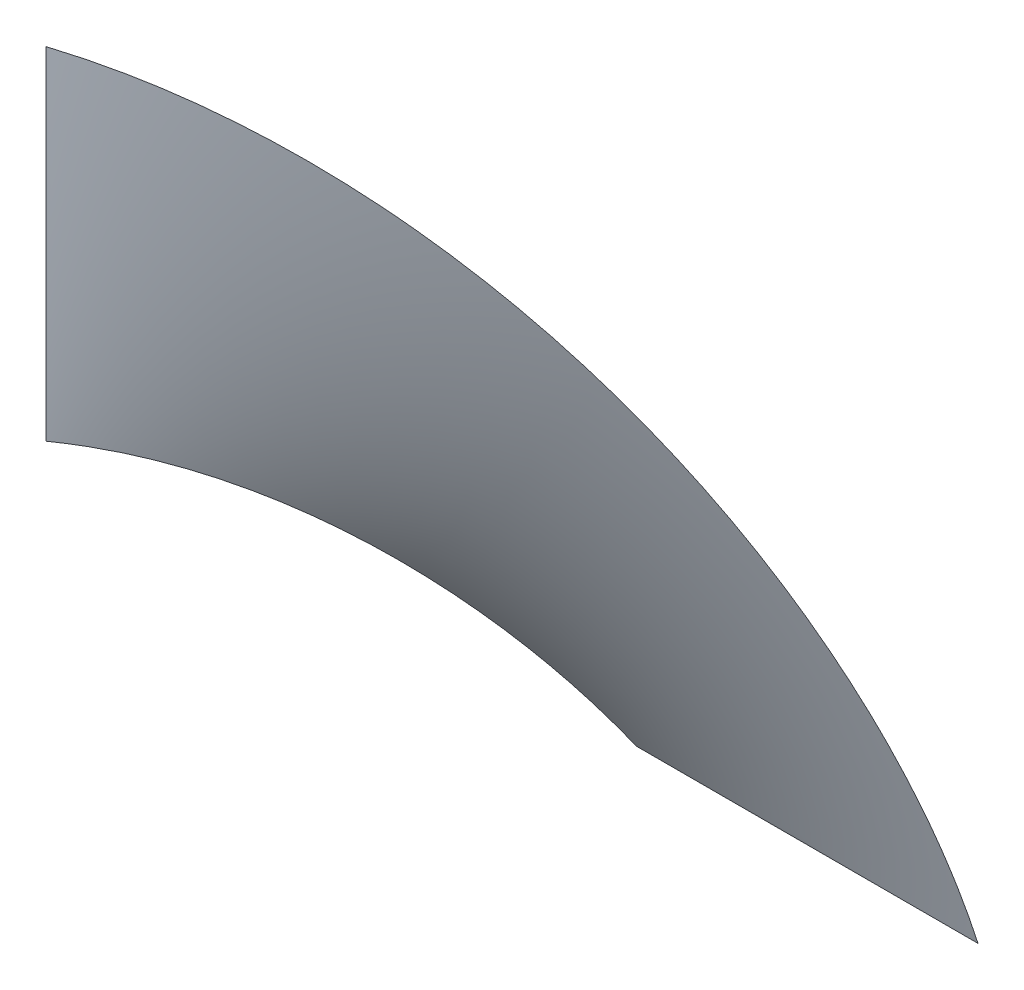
SolidWorks part; units mm, degrees
ref_plane "Спереди" through (0, 0, 0) normal (0, 0, 1) x (1, 0, 0)
ref_plane "Сверху" through (0, 0, 0) normal (0, 1, 0) x (1, 0, 0)
ref_plane "Справа" through (0, 0, 0) normal (1, 0, 0) x (0, 0, -1)
sketch "Эскиз1" plane through (0, 0, 0) normal (0, 0, 1) x (1, 0, 0)
  circle A0 centre (0, 0) radius 45
  dimension "D1" = 90
sketch "Эскиз2" plane through (0, 0, 0) normal (0, 0, 1) x (1, 0, 0)
  line L0 (45, 0) -> (100, 0)
  circle A0 centre (0, 0) radius 45 construction
  dimension "D1" = 100
curve "Спираль1"
surface "Поверхность-По траектории1"
sketch "Эскиз3" plane through (0, 0, 0) normal (0, 0, 1) x (1, 0, 0)
  line L0 (0, 45) -> (0, 100)
  line L2 (45, 0) -> (100, 0)
  arc A0 (0, 45) -> (45, 0) centre (0, 0) cw
  arc A1 (100, 0) -> (0, 100) centre (0, 0) ccw
  spline S1 degree 2 poles (100, 0) (100, 7.494) (98.8831, 14.9042) (97.7662, 22.3145) (95.5573, 29.4755) (93.3484, 36.6365) (90.0969, 43.3884) (86.8454, 50.1402) (82.6239, 56.332) (78.4024, 62.5238) (73.3052, 68.0173) (68.208, 73.5107) (62.349, 78.1831) (56.49, 82.8556) (50, 86.6025) (43.51, 90.3495) (36.5341, 93.0874) (29.5582, 95.8252) (22.2521, 97.4928) (14.946, 99.1604) (7.473, 99.7204) (3.7417, 100) (0, 100) knots 0 0 0 0.02381 0.02381 0.047619 0.047619 0.071429 0.071429 0.095238 0.095238 0.119048 0.119048 0.142857 0.142857 0.166667 0.166667 0.190476 0.190476 0.214286 0.214286 0.238095 0.238095 0.25 0.25 0.25 weights 1 0.997204 1 0.997204 1 0.997204 1 0.997204 1 0.997204 1 0.997204 1 0.997204 1 0.997204 1 0.997204 1 0.997204 1 0.998602 0.998602 construction
extrude "Бобышка-Вытянуть1" add sketch "Эскиз3" along normal up to surface (50 mm away)
ref_plane "Плоскость1" through (22.5, 22.5, 0) normal (-0.7071, -0.7071, 0) x (0.7071, -0.7071, 0)
sketch "Эскиз5" plane through (22.5, 22.5, 0) normal (-0.7071, -0.7071, 0) x (0.7071, -0.7071, 0)
  line L0 (-31.8198, 0) -> (31.8198, 0) construction
  ellipse E0 centre (0, 70.25) end of major axis (-42.8092, 137.5181) minor radius 37.7169 (31.8198, 0) -> (-31.8198, 50) cw
surface "Поверхность-По сечениям1"
other "Сечение1"
